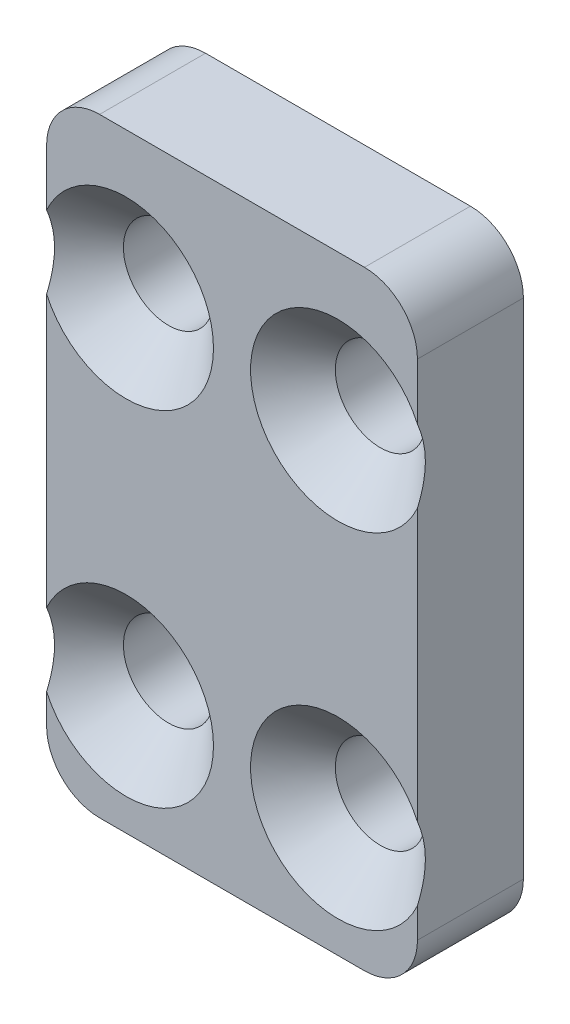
SolidWorks part; units mm, degrees
ref_plane "前视基准面" through (0, 0, 0) normal (0, 0, 1) x (1, 0, 0)
ref_plane "上视基准面" through (0, 0, 0) normal (0, 1, 0) x (1, 0, 0)
ref_plane "右视基准面" through (0, 0, 0) normal (1, 0, 0) x (0, 0, -1)
other "Configuration Table"
sketch "草图1" plane through (0, 0, 0) normal (0, 0, 1) x (1, 0, 0)
  line L1 (-7, 11.5) -> (7, 11.5)
  line L2 (-7, 11.5) -> (-7, -11.5)
  line L3 (-7, -11.5) -> (7, -11.5)
  line L4 (7, 11.5) -> (7, -11.5)
  line L5 (-7, 11.5) -> (7, -11.5) construction
  line L6 (-7, -11.5) -> (7, 11.5) construction
  point P0 (0, 0)
  dimension "D1" = 14
  dimension "D2" = 23
extrude "凸台-拉伸1" add sketch "草图1" along normal blind 4
hole_wizard "M3 十字槽沉头木螺钉的锥形沉头孔1" positions "草图2" profile "草图3" countersink size "M3" standard "GB"
sketch "草图2" plane through (0, 0, 4) normal (0, 0, 1) x (1, 0, 0)
  line L0 (-7, 11.5) -> (-7, -11.5) construction
  line L1 (7, -11.5) -> (7, 11.5) construction
  line L2 (7, 11.5) -> (-7, 11.5) construction
  point P0 (-4, 6)
  point P2 (4, 6)
  point P4 (-4, -7)
  point P6 (4, -7)
  dimension "D1" = 3
  dimension "D2" = 3
  dimension "D3" = 3
  dimension "D4" = 3
  dimension "D5" = 5.5
  dimension "D6" = 5.5
  dimension "D7" = 13
  dimension "D8" = 13
sketch "草图3" plane through (-4, 6, 4) normal (1, 0, 0) x (0, -1, 0)
  line L0 (0, 0) -> (0, 4)
  line L1 (0, 4) -> (1.7, 4)
  line L2 (1.7, 4) -> (1.7, 1.6)
  line L3 (1.7, 1.6) -> (3.3, 0)
  line L5 (3.3, 0) -> (0, 0)
  line L6 (-1.7, 1.6) -> (-3.3, 0) construction
  line L11 (0, -6.35) -> (0, 107.95) construction
  dimension "通孔孔直径" = 3.4
  dimension "通孔孔深度" = 4
  dimension "近端锥形沉头孔直径" = 6.6
  dimension "近端锥形沉头孔角度" = 90
fillet "圆角1" radius 2 4 edges at (7, -11.5, 2) (-7, -11.5, 2) (7, 11.5, 2) (-7, 11.5, 2)
